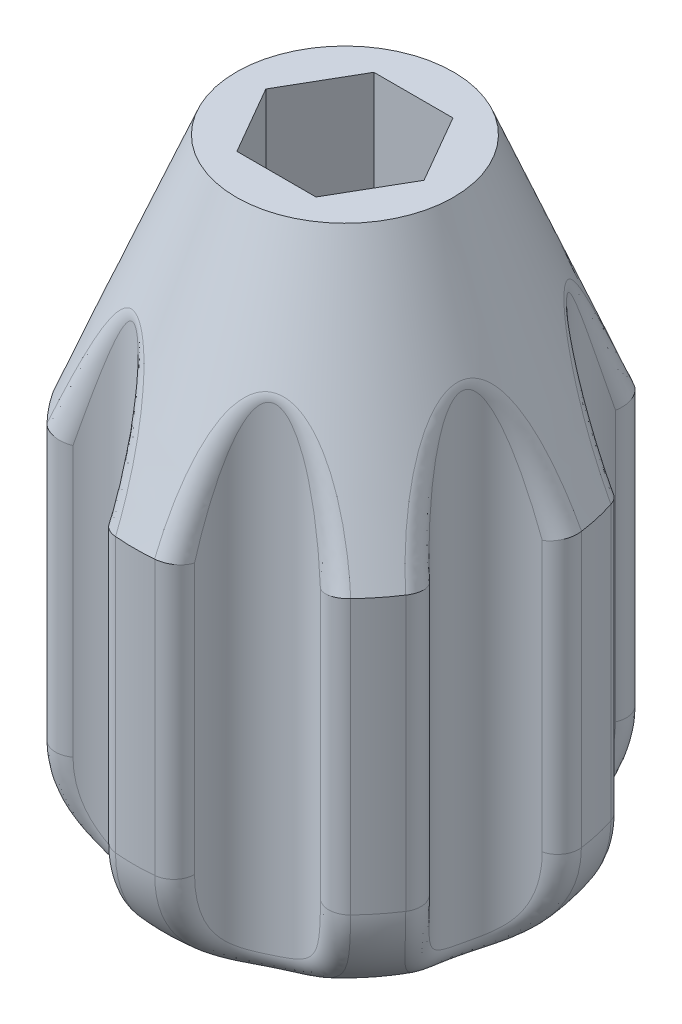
SolidWorks part; units mm, degrees
ref_plane "Front Plane" through (0, 0, 0) normal (0, 0, 1) x (1, 0, 0)
ref_plane "Top Plane" through (0, 0, 0) normal (0, 1, 0) x (1, 0, 0)
ref_plane "Right Plane" through (0, 0, 0) normal (1, 0, 0) x (0, 0, -1)
sketch "Sketch1" plane through (0, 0, 0) normal (0, 1, 0) x (1, 0, 0)
  circle A0 centre (0, 0) radius 10
  dimension "D1" = 20
extrude "Boss-Extrude1" add sketch "Sketch1" along normal blind 30
fillet "Fillet1" radius 5 1 edges at (0, 0, 10)
chamfer "Chamfer1" distance 12 angle 22 1 edges at (0, 30, 10)
sketch "Sketch3" plane through (0, 30, 0) normal (0, 1, 0) x (1, 0, 0)
  circle A0 centre (0, 10) radius 2.5
  circle A1 centre (0, 0) radius 10 construction
  dimension "D1" = 5
extrude "Cut-Extrude1" cut sketch "Sketch3" against normal blind 30
fillet "Fillet2" radius 1 4 edges at (0.0774, 24.1838, -7.5012) (-0.2317, 0.6782, -7.5108) (2.4804, 11.5, -9.6875) (-2.4804, 11.5, -9.6875)
pattern_circular "CirPattern3" count 7 over 360 about axis through (0, 30, 0) along (0, -1, 0) of "Cut-Extrude1", "Fillet2"
sketch "Sketch4" plane through (0, 30, 0) normal (0, 1, 0) x (1, 0, 0)
  line L1 (3.7528, 0) -> (1.8764, 3.25)
  line L2 (1.8764, 3.25) -> (-1.8764, 3.25)
  line L3 (-1.8764, 3.25) -> (-3.7528, 0)
  line L4 (-3.7528, 0) -> (-1.8764, -3.25)
  line L5 (-1.8764, -3.25) -> (1.8764, -3.25)
  line L6 (1.8764, -3.25) -> (3.7528, 0)
  circle A0 centre (0, 0) radius 3.25 construction
  dimension "D1" = 6.5
extrude "Cut-Extrude2" cut sketch "Sketch4" against normal blind 10
